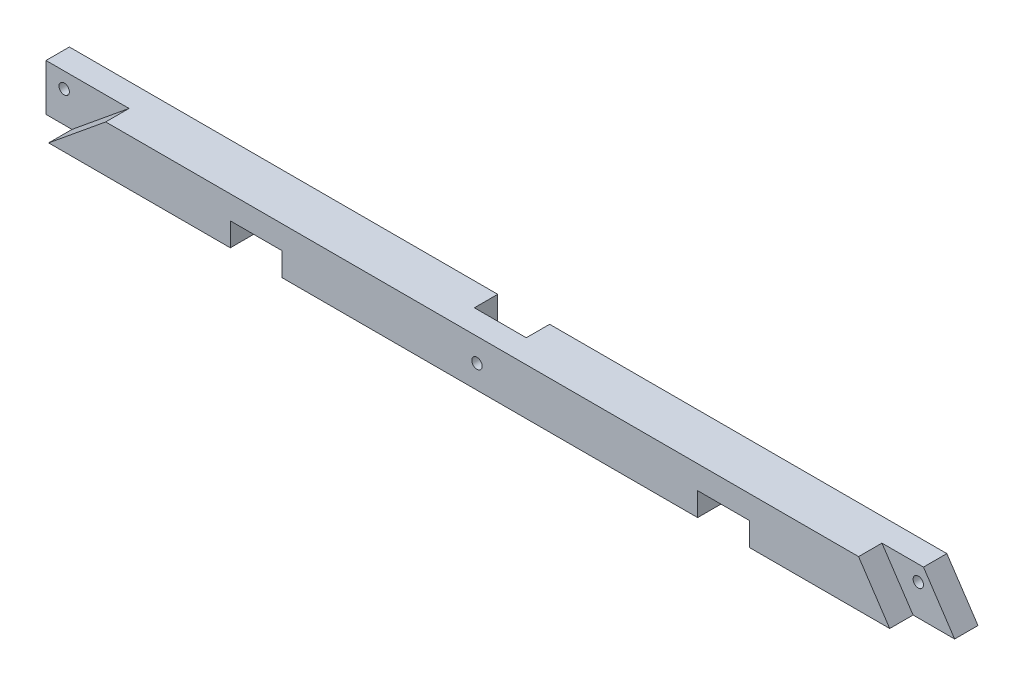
SolidWorks part; units mm, degrees
ref_plane "Plan de face" through (0, 0, 0) normal (0, 0, 1) x (1, 0, 0)
ref_plane "Plan de dessus" through (0, 0, 0) normal (0, 1, 0) x (1, 0, 0)
ref_plane "Plan de droite" through (0, 0, 0) normal (1, 0, 0) x (0, 0, -1)
sketch "Esquisse1" plane through (0, 0, 0) normal (0, 0, 1) x (1, 0, 0)
  line L1 (0, 0) -> (175, 0)
  line L2 (0, 0) -> (0, 9)
  line L3 (0, 9) -> (175, 9)
  line L4 (175, 0) -> (175, 9)
  dimension "D1" = 175
  dimension "D2" = 9
extrude "Extrusion1" add sketch "Esquisse1" along normal blind 9
sketch "Esquisse2" plane through (0, 0, 9) normal (0, 0, 1) x (1, 0, 0)
  line L0 (0, 9) -> (16, 9)
  line L1 (175, 9) -> (0, 9) construction
  line L2 (16, 9) -> (5, 0)
  line L3 (0, 0) -> (175, 0) construction
  line L4 (5, 0) -> (0, 0)
  line L5 (0, 0) -> (0, 9)
  dimension "D1" = 16
  dimension "D2" = 5
extrude "Enlèv. mat.-Extru.1" cut sketch "Esquisse2" against normal blind 4.5
sketch "Esquisse3" plane through (0, 0, 4.5) normal (0, 0, 1) x (1, 0, 0)
  line L0 (0, 9) -> (0, 0) construction
  line L1 (16, 9) -> (0, 9) construction
  circle A0 centre (3.5, 6) radius 1
  dimension "D3" = 2
  dimension "D1" = 3.5
  dimension "D2" = 3
extrude "Enlèv. mat.-Extru.2" cut sketch "Esquisse3" against normal blind 4.5
sketch "Esquisse4" plane through (0, 0, 9) normal (0, 0, 1) x (1, 0, 0)
  line L0 (175, 9) -> (169, 9)
  line L1 (175, 9) -> (16, 9) construction
  line L2 (169, 9) -> (175, 0)
  line L3 (175, 0) -> (175, 9)
  dimension "D1" = 6
extrude "Enlèv. mat.-Extru.3" cut sketch "Esquisse4" against normal blind 9
sketch "Esquisse5" plane through (0, 0, 9) normal (0, 0, 1) x (1, 0, 0)
  line L0 (169, 9) -> (161, 9)
  line L1 (169, 9) -> (16, 9) construction
  line L2 (161, 9) -> (167, 0)
  line L3 (5, 0) -> (175, 0) construction
  line L4 (167, 0) -> (175, 0)
  line L5 (175, 0) -> (169, 9)
  dimension "D1" = 8
  dimension "D2" = 8
extrude "Enlèv. mat.-Extru.4" cut sketch "Esquisse5" against normal blind 4.5
sketch "Esquisse6" plane through (0, 0, 4.5) normal (0, 0, 1) x (1, 0, 0)
  line L0 (169, 9) -> (161, 9) construction
  circle A0 centre (168, 6) radius 1
  dimension "D3" = 2
  dimension "D1" = 7
  dimension "D2" = 3
extrude "Enlèv. mat.-Extru.5" cut sketch "Esquisse6" against normal blind 4.5
sketch "Esquisse7" plane through (0, 0, 0) normal (0, 0, -1) x (-1, 0, 0)
  line L0 (0, 0) -> (-175, 0) construction
  line L1 (-92.5, 0) -> (-82.5, 0)
  line L2 (-92.5, 0) -> (-92.5, 9)
  line L3 (-92.5, 9) -> (-82.5, 9)
  line L4 (-82.5, 0) -> (-82.5, 9)
  line L5 (-169, 9) -> (0, 9) construction
  dimension "D1" = 10
  dimension "D2" = 82.5
  dimension "D3" = 82.5
extrude "Enlèv. mat.-Extru.6" cut sketch "Esquisse7" against normal blind 4.5
sketch "Esquisse8" plane through (0, 0, 4.5) normal (0, 0, -1) x (-1, 0, 0)
  line L0 (-82.5, 0) -> (-82.5, 9) construction
  line L1 (-92.5, 0) -> (-82.5, 0) construction
  circle A0 centre (-87.5, 4.5) radius 1
  dimension "D3" = 2
  dimension "D1" = 5
  dimension "D2" = 4.5
extrude "Enlèv. mat.-Extru.7" cut sketch "Esquisse8" against normal blind 4.5
sketch "Esquisse9" plane through (0, 0, 0) normal (0, 0, -1) x (-1, 0, 0)
  line L1 (-40, 0) -> (-50, 0)
  line L2 (-40, 0) -> (-40, 4.5)
  line L3 (-40, 4.5) -> (-50, 4.5)
  line L4 (-50, 0) -> (-50, 4.5)
  line L5 (-92.5, 0) -> (-175, 0) construction
  line L6 (-130, 0) -> (-140, 0)
  line L7 (-130, 0) -> (-130, 4.5)
  line L8 (-130, 4.5) -> (-140, 4.5)
  line L9 (-140, 0) -> (-140, 4.5)
  dimension "D1" = 40
  dimension "D2" = 10
  dimension "D3" = 4.5
  dimension "D4" = 10
  dimension "D5" = 80
  dimension "D6" = 4.5
extrude "Enlèv. mat.-Extru.8" cut sketch "Esquisse9" against normal blind 9
